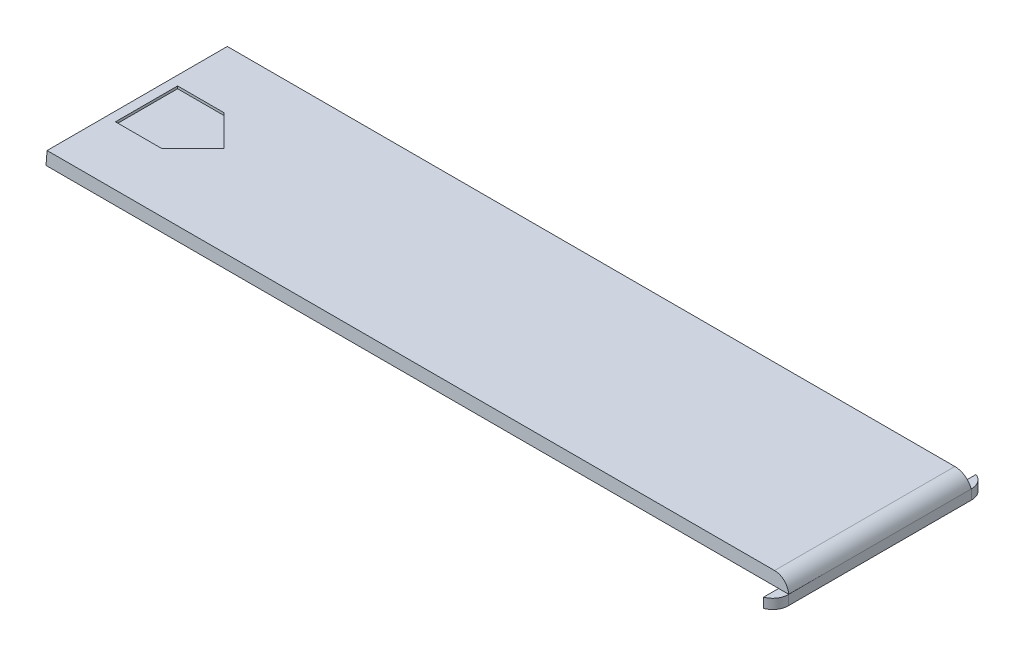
SolidWorks part; units mm, degrees
ref_plane "Front" through (0, 0, 0) normal (0, 0, 1) x (1, 0, 0)
ref_plane "Top" through (0, 0, 0) normal (0, 1, 0) x (1, 0, 0)
ref_plane "Right" through (0, 0, 0) normal (1, 0, 0) x (0, 0, -1)
sketch "Sketch2" plane through (0, 0, 0) normal (0, 1, 0) x (1, 0, 0)
  line L0 (-121.412, 0) -> (-1.651, 0) construction
  line L1 (-121.412, 0) -> (0, 0)
  line L3 (-121.412, 29.8196) -> (-1.651, 29.8196) construction
  line L4 (-121.412, 29.8196) -> (0, 29.8196)
  line L6 (-121.412, 29.8196) -> (-121.412, 0)
  line L7 (0, 0) -> (0, 29.8196)
  line L8 (0, -50) -> (0, 50) construction
  dimension "D1" = 121.412
extrude "Base-Extrude" add sketch "Sketch2" along normal blind 2.032
draft "Draft1" type of draft neutral plane draft angle 5 neutral plane "Top" faces to draft 2 parameters "D1"=5
fillet "Fillet3" radius 2.54 1 edges at (0, 2.032, -14.9098)
sketch "Sketch3" plane through (0, 0, 0) normal (0, -1, 0) x (1, 0, 0)
  line L5 (0, 0) -> (0, -29.8196) construction
  line L10 (0, 0.0762) -> (0, -29.8958)
  line L11 (-1.651, -32.2751) -> (-1.651, 2.4556)
  arc A2 (-1.651, -32.2751) -> (0, -29.8958) centre (-2.54, -29.8958) ccw
  arc A4 (0, 0.0762) -> (-1.651, 2.4556) centre (-2.54, 0.0762) ccw
  point P5 (0, -14.9098)
  point P6 (0, -14.9098)
  dimension "D2" = 2.54
  dimension "D1" = 34.7307
  dimension "D3" = 1.651
extrude "Boss-Extrude1" add sketch "Sketch3" along normal blind 1.6002
sketch "Sketch4" plane through (0, 0, 0) normal (0, -1, 0) x (1, 0, 0)
  line L0 (-120.3447, -18.4658) -> (-121.8687, -18.4658)
  line L1 (-119.0747, -17.1958) -> (-119.0747, -12.6238)
  line L2 (-121.8687, -11.3538) -> (-120.3447, -11.3538)
  line L3 (-123.1387, -12.6238) -> (-123.1387, -17.1958)
  line L5 (-123.1387, -18.7198) -> (-121.412, -18.7198) construction
  line L6 (-123.1387, -11.0998) -> (-121.412, -11.0998) construction
  line L8 (-121.412, -29.8196) -> (-121.412, 0) construction
  arc A0 (-120.3447, -11.3538) -> (-119.0747, -12.6238) centre (-120.3447, -12.6238) cw
  arc A1 (-119.0747, -17.1958) -> (-120.3447, -18.4658) centre (-120.3447, -17.1958) cw
  arc A2 (-123.1387, -17.1958) -> (-121.8687, -18.4658) centre (-121.8687, -17.1958) ccw
  arc A3 (-123.1387, -12.6238) -> (-121.8687, -11.3538) centre (-121.8687, -12.6238) cw
  dimension "D4" = 1.27
  dimension "D1" = 0.254
  dimension "D2" = 0.254
  dimension "D3" = 4.064
  dimension "D5" = 1.7267
extrude "Boss-Extrude2" add sketch "Sketch4" along normal blind 1.905
sketch "Sketch5" plane through (-217.9276, 2.032, 0) normal (0, -1, 0) x (1, 0, 0)
  line L0 (105.6596, -19.9898) -> (98.0396, -19.9898)
  line L1 (96.5156, -29.6418) -> (96.5156, -0.1778) construction
  line L2 (98.0396, -9.8298) -> (105.6596, -9.8298)
  line L3 (98.0396, -9.8298) -> (98.0396, -19.9898)
  line L4 (105.6596, -9.8298) -> (110.7396, -14.9098)
  line L5 (110.7396, -14.9098) -> (105.6596, -19.9898)
  point P5 (96.5156, -14.9098)
  dimension "D1" = 10.16
  dimension "D2" = 7.62
  dimension "D3" = 12.7
  dimension "D4" = 1.524
extrude "Cut-Extrude3" cut sketch "Sketch5" along normal blind 0.381 draft 3
